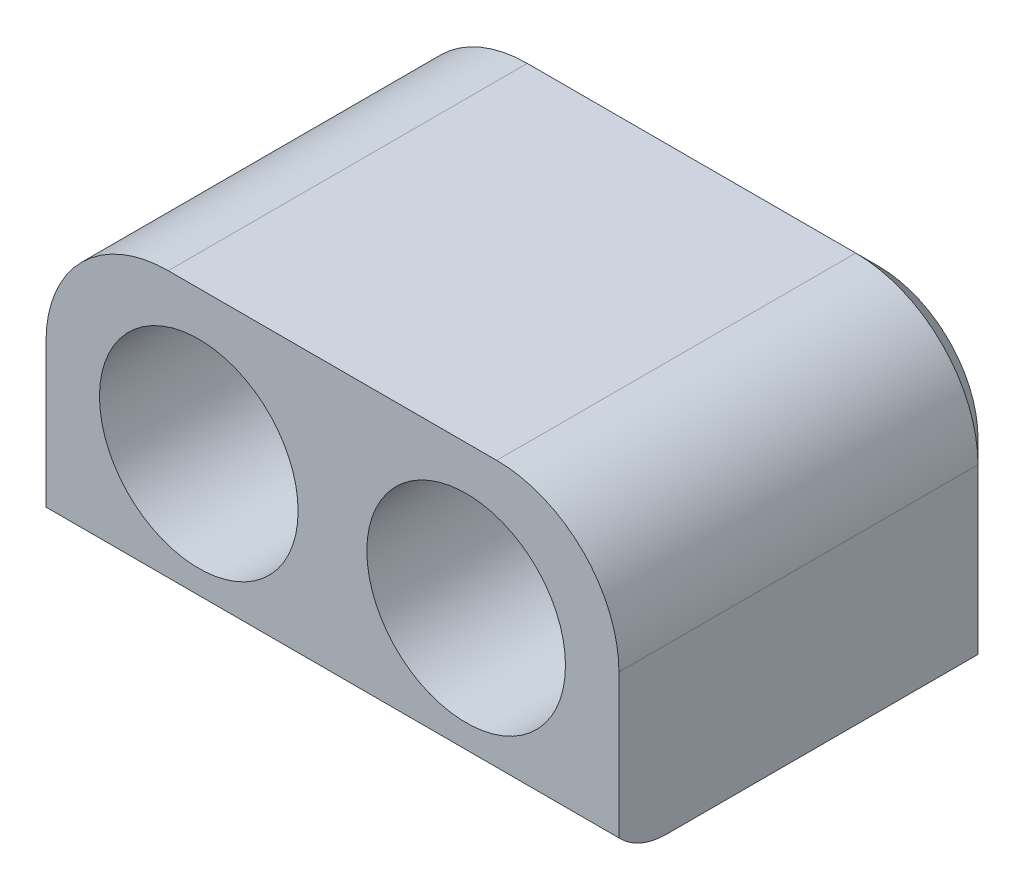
SolidWorks part; units mm, degrees
ref_plane "Front Plane" through (0, 0, 0) normal (0, 0, 1) x (1, 0, 0)
ref_plane "Top Plane" through (0, 0, 0) normal (0, 1, 0) x (1, 0, 0)
ref_plane "Right Plane" through (0, 0, 0) normal (1, 0, 0) x (0, 0, -1)
sketch "Sketch3" plane through (0, 0, 0) normal (0, 0, 1) x (1, 0, 0)
  line L0 (0, -5.2388) -> (0, 5.2388) construction
  line L1 (0, 9.525) -> (19.05, 9.525)
  line L2 (0, 9.525) -> (0, 0)
  line L3 (0, 0) -> (19.05, 0)
  line L4 (19.05, 9.525) -> (19.05, 0)
  dimension "D1" = 9.525
  dimension "D2" = 19.05
extrude "Extrude1" add sketch "Sketch3" against normal blind 12.7
fillet "Fillet1" radius 4.064 2 edges at (19.05, 9.525, -6.35) (0, 9.525, -6.35)
hole_wizard "#6 CBORE" positions "Sketch7" profile "Sketch6" counterbore size "#6" standard "ANSI Inch"
sketch "Sketch7" plane through (0, 0, 0) normal (0, 0, 1) x (1, 0, 0)
  line L1 (-2.0915, 4.7625) -> (49997.9085, 4.7625) construction
  line L2 (14.986, 9.525) -> (4.064, 9.525) construction
  line L3 (0, 0) -> (19.05, 0) construction
  line L4 (0, 5.461) -> (0, 0) construction
  point P0 (5.08, 4.7625)
  point P1 (13.97, 4.7625)
  dimension "D1" = 5.08
  dimension "D2" = 13.97
sketch "Sketch6" plane through (5.08, 4.7625, 0) normal (1, 0, 0) x (0, -1, 0)
  line L0 (0, 0) -> (0, 12.7)
  line L1 (0, 12.7) -> (2.159, 12.7)
  line L3 (2.159, 12.7) -> (2.159, 4.826)
  line L4 (2.159, 4.826) -> (3.302, 4.826)
  line L5 (3.302, 4.826) -> (3.302, 0)
  line L7 (3.302, 0) -> (0, 0)
  line L11 (0, -6.35) -> (0, 107.95) construction
  dimension "Thru Hole Dia." = 4.318
  dimension "Thru Hole Depth" = 12.7
  dimension "C'Bore Dia." = 6.604
  dimension "C'Bore Depth" = 4.826
sketch "Sketch8" plane through (0, 0, 0) normal (-1, 0, 0) x (0, 0, 1)
  line L0 (0, 0.6851) -> (1.27, 0.6851)
  line L1 (1.27, 0.6851) -> (1.27, -1.8549)
  line L2 (-1.5748, -1.8549) -> (-1.5748, 0)
  line L3 (1.27, -1.8549) -> (-1.5748, -1.8549)
  line L4 (-12.7, 0) -> (0, 0) construction
  line L13 (-12.7, 0) -> (0, 0) construction
  line L14 (0, 5.461) -> (0, 0) construction
  arc A0 (-1.5748, 0) -> (0, 0.6851) centre (-1.5748, 2.1525) ccw
  dimension "D4" = 2.54
  dimension "D5" = 1.27
extrude "Cut-Extrude1" cut sketch "Sketch8" against normal through all
chamfer "Chamfer1" distance 0.762 angle 45 5 edges at (9.525, 9.525, -12.7) (19.05, 2.7305, -12.7) (17.8597, 8.3347, -12.7) (0, 2.7305, -12.7) (1.1903, 8.3347, -12.7)
